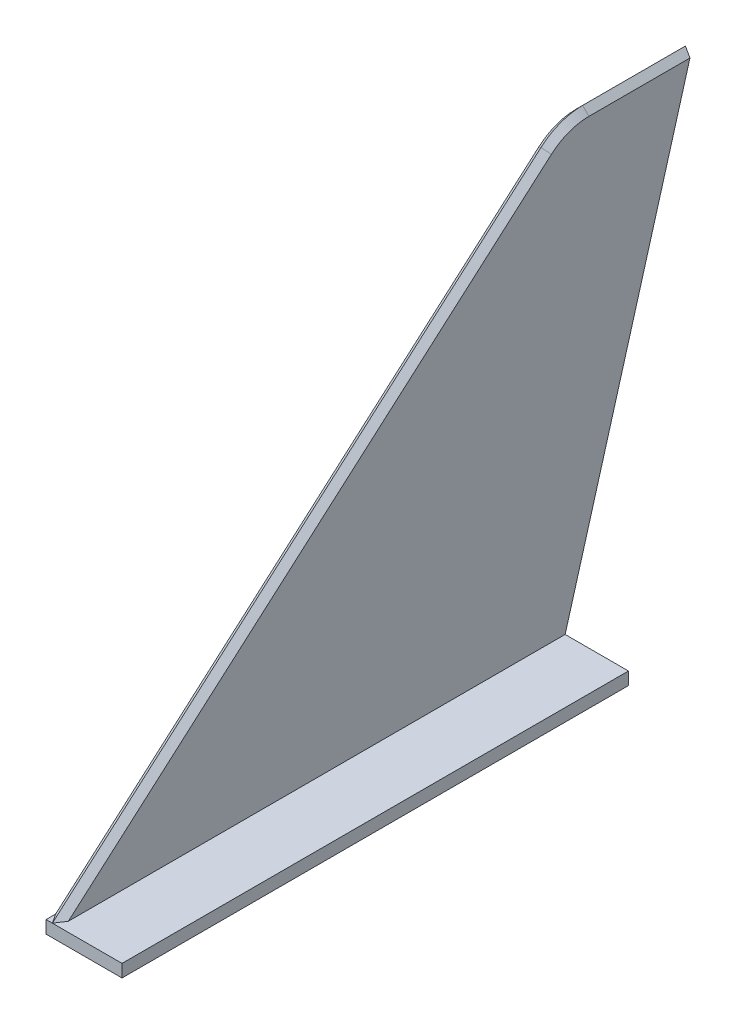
SolidWorks part; units mm, degrees
ref_plane "Plan de face" through (0, 0, 0) normal (0, 0, 1) x (1, 0, 0)
ref_plane "Plan de dessus" through (0, 0, 0) normal (0, 1, 0) x (1, 0, 0)
ref_plane "Plan de droite" through (0, 0, 0) normal (1, 0, 0) x (0, 0, -1)
sketch "Esquisse1" plane through (0, 0, 0) normal (1, 0, 0) x (0, 0, -1)
  line L0 (0, 0) -> (-80, 0)
  line L1 (-80, 0) -> (-2.8277, 67.5258)
  line L2 (3.7574, 70) -> (20, 70)
  line L3 (20, 70) -> (0, 0)
  arc A0 (-2.8277, 67.5258) -> (3.7574, 70) centre (3.7574, 60) cw
  point P7 (0, 70)
  dimension "D4" = 10
  dimension "D1" = 80
  dimension "D2" = 20
  dimension "D3" = 70
extrude "Extrusion1" add sketch "Esquisse1" along normal mid plane 2
chamfer "Chanfrein1" distance 1 angle 45 6 edges at (-1, 70, -11.8787) (-1, 69.361, -0.2401) (-1, 33.7629, 41.4138) (1, 70, -11.8787) (1, 69.361, -0.2401) (1, 33.7629, 41.4138)
sketch "Esquisse2" plane through (0, 0, 0) normal (0, -1, 0) x (1, 0, 0)
  line L1 (-1, 0) -> (11, 0)
  line L2 (-1, 0) -> (-1, 80)
  line L3 (-1, 80) -> (11, 80)
  line L4 (11, 0) -> (11, 80)
  dimension "D1" = 12
extrude "Extrusion2" add sketch "Esquisse2" along normal blind 2
